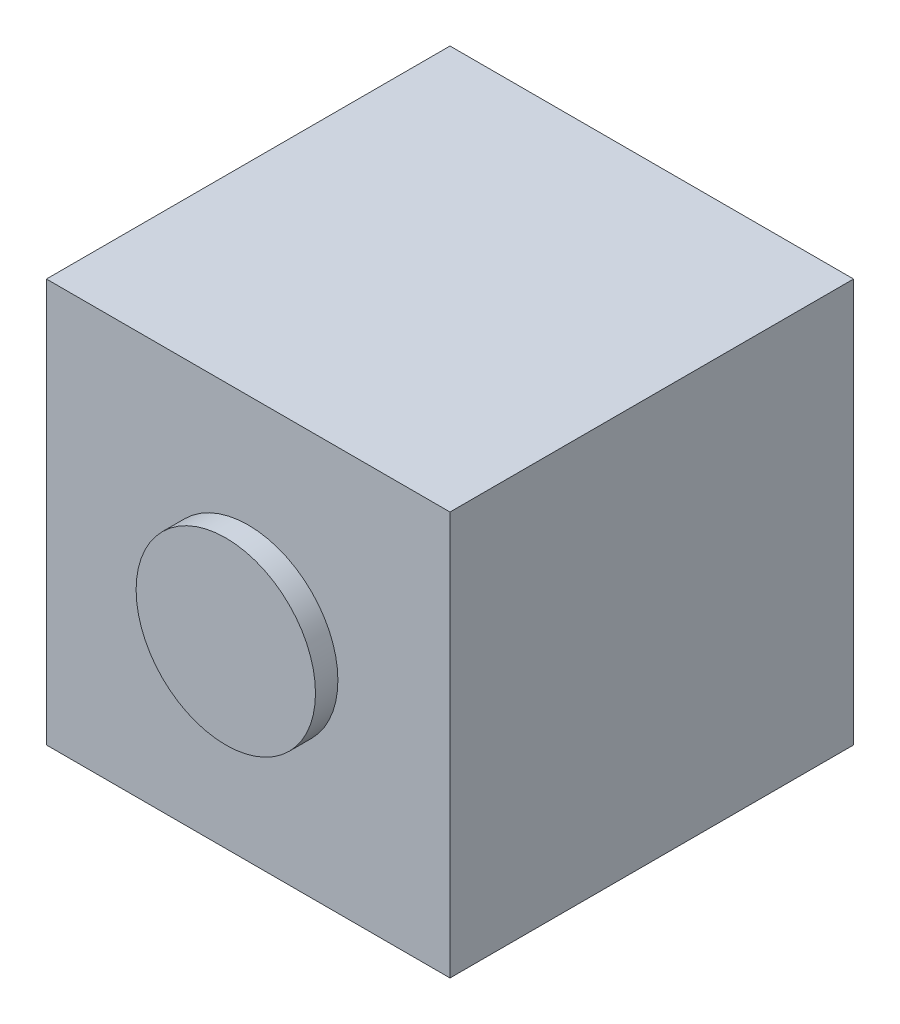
SolidWorks part; units mm, degrees
ref_plane "Front Plane" through (0, 0, 0) normal (0, 0, 1) x (1, 0, 0)
ref_plane "Top Plane" through (0, 0, 0) normal (0, 1, 0) x (1, 0, 0)
ref_plane "Right Plane" through (0, 0, 0) normal (1, 0, 0) x (0, 0, -1)
sketch "Sketch1" plane through (0, 0, 0) normal (0, 0, 1) x (1, 0, 0)
  line L1 (0, 0) -> (500, 0)
  line L2 (0, 0) -> (0, 500)
  line L3 (0, 500) -> (500, 500)
  line L4 (500, 0) -> (500, 500)
  dimension "D1" = 500
  dimension "D2" = 500
extrude "Boss-Extrude1" add sketch "Sketch1" along normal blind 500
scale "Scale1" scale about centroid uniform scaling yes scale factor 0.09
sketch "Sketch3" plane through (0, 0, 272.5) normal (0, 0, 1) x (1, 0, 0)
  line L0 (250, 272.5) -> (250, 227.5) construction
  line L1 (272.5, 272.5) -> (227.5, 272.5) construction
  line L2 (227.5, 227.5) -> (272.5, 227.5) construction
  circle A0 centre (250, 250) radius 10
extrude "Boss-Extrude2" add sketch "Sketch3" along normal blind 2.5
